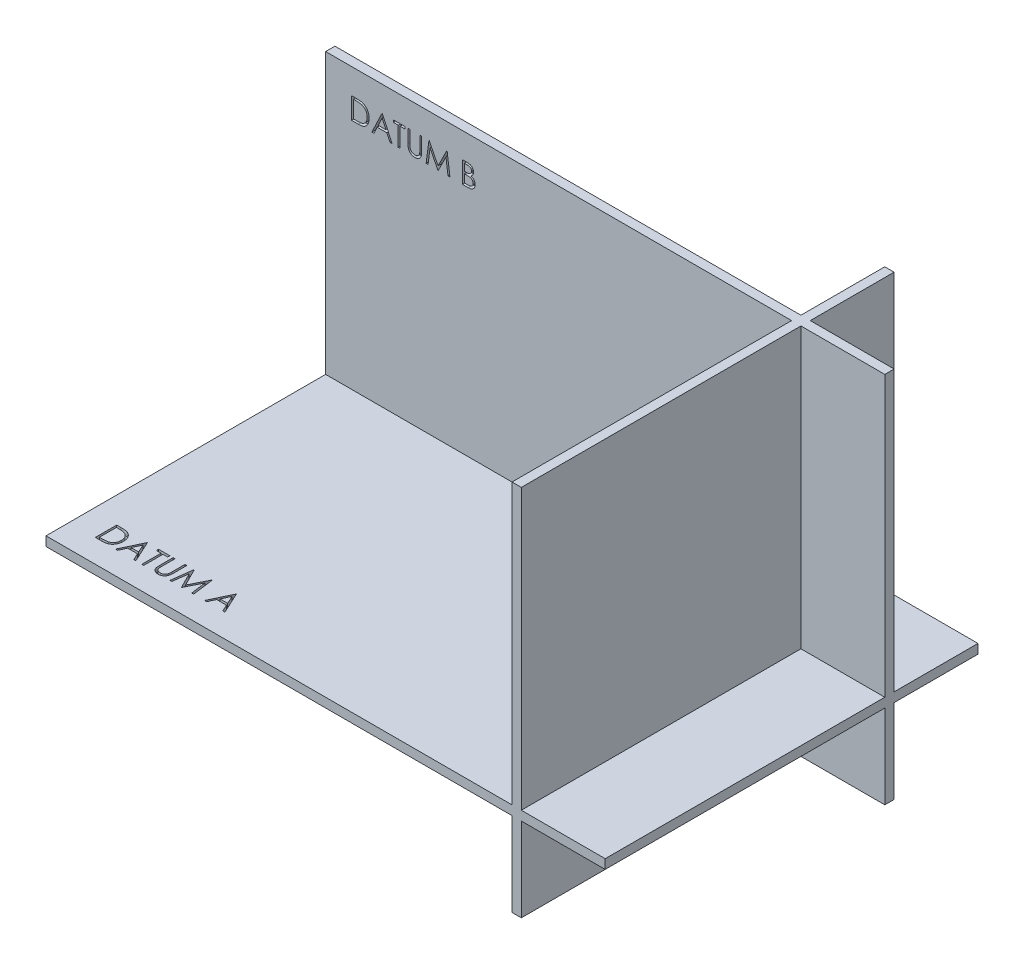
SolidWorks part; units mm, degrees
ref_plane "Front Plane" through (0, 0, 0) normal (0, 0, 1) x (1, 0, 0)
ref_plane "Top Plane" through (0, 0, 0) normal (0, 1, 0) x (1, 0, 0)
ref_plane "Right Plane" through (0, 0, 0) normal (1, 0, 0) x (0, 0, -1)
sketch "Sketch1" plane through (0, 0, 0) normal (0, 0, 1) x (1, 0, 0)
  line L0 (0, 76.2) -> (0, -25.4) construction
  line L1 (25.4, -25.4) -> (-127, -25.4)
  line L2 (25.4, -25.4) -> (25.4, 76.2)
  line L3 (25.4, 76.2) -> (-127, 76.2)
  line L4 (-127, -25.4) -> (-127, 76.2)
  line L5 (25.4, -25.4) -> (-127, 76.2) construction
  line L6 (25.4, 76.2) -> (-127, -25.4) construction
  line L7 (-127, 0) -> (25.4, 0) construction
  point P0 (-50.8, 25.4)
  dimension "D1" = 25.4
  dimension "D2" = 25.4
  dimension "D3" = 101.6
  dimension "D4" = 152.4
extrude "Front Datum B" add sketch "Sketch1" against normal blind 2.54
sketch "Sketch4" plane through (0, 0, 0) normal (0, 0, 1) x (1, 0, 0)
  line L0 (-120.65, 76.2) -> (-120.65, 57.15) construction
  line L1 (-127, 76.2) -> (-76.2, 76.2) construction
  line L2 (-127, 76.2) -> (-127, 57.15) construction
  line L3 (-127, 57.15) -> (-76.2, 57.15) construction
  line L4 (-76.2, 76.2) -> (-76.2, 57.15) construction
  line L5 (-127, 63.5) -> (-76.2, 63.5) construction
  text T0 "DATUM B" font "Century Gothic" height in points 22
  point P10 (-120.65, 63.5)
  dimension "D1" = 19.05
  dimension "D2" = 50.8
  dimension "D3" = 6.35
  dimension "D4" = 6.35
extrude "Datum B text" cut sketch "Sketch4" against normal blind 1.27
sketch "Sketch2" plane through (0, 0, 0) normal (0, 1, 0) x (1, 0, 0)
  line L0 (0, 25.4) -> (0, -76.2) construction
  line L1 (25.4, -76.2) -> (-127, -76.2)
  line L2 (25.4, -76.2) -> (25.4, 25.4)
  line L3 (25.4, 25.4) -> (-127, 25.4)
  line L4 (-127, -76.2) -> (-127, 25.4)
  line L5 (25.4, -76.2) -> (-127, 25.4) construction
  line L6 (25.4, 25.4) -> (-127, -76.2) construction
  line L7 (-127, 0) -> (25.4, 0) construction
  line L8 (-127, 2.54) -> (-127, 0) construction
  point P0 (-50.8, -25.4)
  dimension "D1" = 25.4
  dimension "D2" = 25.4
  dimension "D3" = 101.6
extrude "Top Datum A" add sketch "Sketch2" against normal blind 2.54
sketch "Sketch6" plane through (0, 0, 0) normal (0, 1, 0) x (1, 0, 0)
  line L0 (-120.65, -57.15) -> (-120.65, -76.2) construction
  line L1 (-127, -57.15) -> (-76.2, -57.15) construction
  line L2 (-127, -57.15) -> (-127, -76.2) construction
  line L3 (-127, -76.2) -> (-76.2, -76.2) construction
  line L4 (-76.2, -57.15) -> (-76.2, -76.2) construction
  line L5 (-127, -69.85) -> (-76.2, -69.85) construction
  text T0 "DATUM A" font "Century Gothic" height in points 22
  point P9 (-120.65, -69.85)
  dimension "D1" = 19.05
  dimension "D2" = 50.8
  dimension "D3" = 6.35
  dimension "D4" = 6.35
extrude "Datum A text" cut sketch "Sketch6" against normal blind 1.27
sketch "Sketch3" plane through (0, 0, 0) normal (1, 0, 0) x (0, 0, -1)
  line L0 (0, 76.2) -> (0, -25.4) construction
  line L1 (25.4, -25.4) -> (-76.2, -25.4)
  line L2 (25.4, -25.4) -> (25.4, 76.2)
  line L3 (25.4, 76.2) -> (-76.2, 76.2)
  line L4 (-76.2, -25.4) -> (-76.2, 76.2)
  line L5 (25.4, -25.4) -> (-76.2, 76.2) construction
  line L6 (25.4, 76.2) -> (-76.2, -25.4) construction
  line L7 (-76.2, 0) -> (25.4, 0) construction
  line L8 (2.54, 76.2) -> (0, 76.2) construction
  line L9 (-76.2, -2.54) -> (-76.2, 0) construction
  point P0 (-25.4, 25.4)
  dimension "D1" = 25.4
  dimension "D2" = 25.4
extrude "Right Datum C" add sketch "Sketch3" along normal blind 2.54
sketch "Sketch7" plane through (0, 0, 0) normal (-1, 0, 0) x (0, 0, 1)
  line L0 (31.75, 76.2) -> (31.75, 57.15) construction
  line L1 (25.4, 76.2) -> (76.2, 76.2) construction
  line L2 (25.4, 76.2) -> (25.4, 57.15) construction
  line L3 (25.4, 57.15) -> (76.2, 57.15) construction
  line L4 (76.2, 76.2) -> (76.2, 57.15) construction
  line L5 (25.4, 63.5) -> (76.2, 63.5) construction
  text T0 "DATUM C" font "Century Gothic" height in points 22
  point P9 (31.75, 63.5)
extrude "Datum C text" cut sketch "Sketch7" against normal blind 1.27
